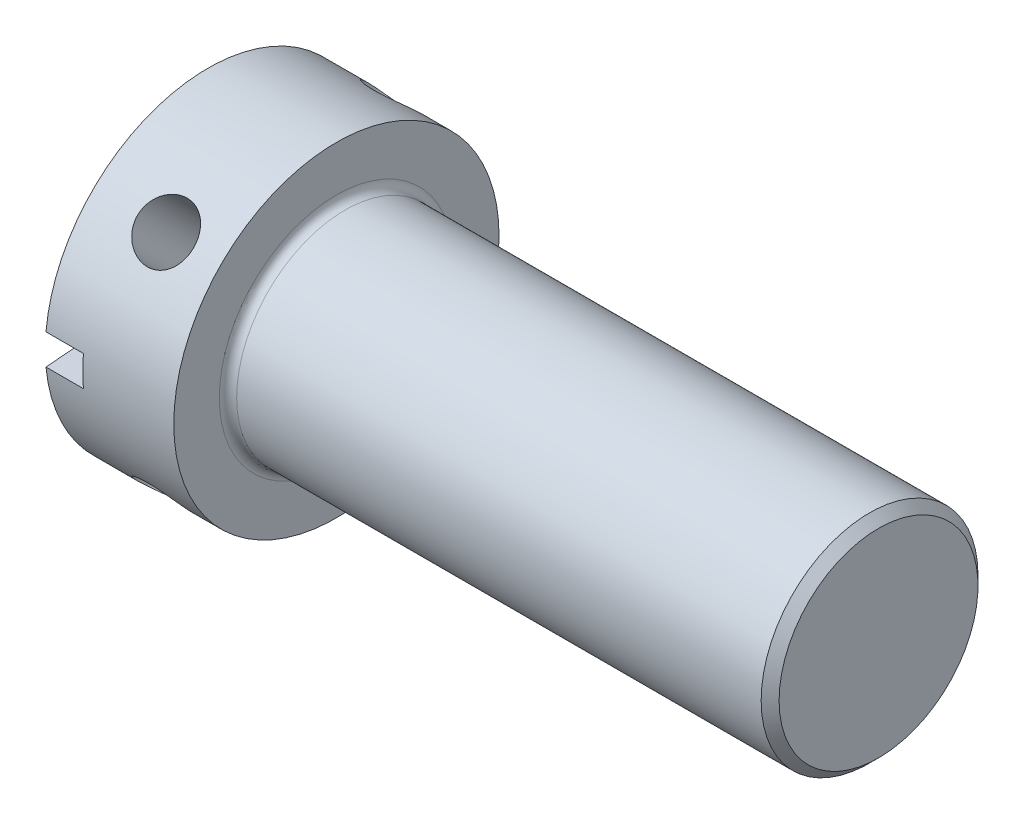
SolidWorks part; units mm, degrees
ref_plane "Plane1" through (0, 0, 0) normal (0, 0, 1) x (1, 0, 0)
ref_plane "Plane2" through (0, 0, 0) normal (0, 1, 0) x (1, 0, 0)
ref_plane "Plane3" through (0, 0, 0) normal (1, 0, 0) x (0, 0, -1)
sketch "BodySke" plane through (0, 0, 0) normal (0, 0, 1) x (1, 0, 0)
  line L1 (0.65, 15) -> (12.5, 15)
  line L2 (12.5, 15) -> (12.5, 10)
  line L3 (12.5, 10) -> (61.672, 10)
  line L4 (62.5, 9.172) -> (62.5, 0)
  line L5 (62.5, 0) -> (0, 0)
  line L6 (-31.75, 0) -> (127, 0) construction
  line L7 (0.65, 15) -> (0.65, -2.9344) construction
  line L8 (62.5, 9.172) -> (61.672, 10)
  line L10 (62.5, -9.172) -> (61.672, -10) construction
  line L11 (14, 4.525) -> (14, -1.825) construction
  line L12 (22.5, 4.525) -> (22.5, -1.825) construction
  line L13 (2.5, 4.525) -> (2.5, -1.825) construction
  arc A0 (0, 0) -> (0.65, 15) centre (173.4019, 0) cw
  dimension "Diameter" = 20
  dimension "Head_ht" = 12.5
  dimension "Length" = 50
  dimension "Body_ch_ang" = 45
  dimension "Head_dia" = 30
  dimension "Minor_dia" = 18.344
  dimension "Advance" = 1.5
  dimension "Thread_nom" = 40
  dimension "Thread_length" = 60
  dimension "Curve" = 0.65
revolve "Base-Revolve" add sketch "BodySke"
fillet "Fillet1" radius 0.8 1 edges at (12.5, 0, 10)
sketch "ThdSchSke" plane through (0, 0, 0) normal (0, 0, 1) x (1, 0, 0)
  line L0 (22.5, -9.172) -> (21.9202, -10)
  line L1 (22.5, -9.172) -> (23.0798, -10)
  line L2 (23.0798, -10) -> (23.0798, -12.5)
  line L3 (-3.175, 0) -> (5.1513, 0) construction
  line L5 (23.0798, -12.5) -> (21.9202, -12.5)
  line L6 (21.9202, -12.5) -> (21.9202, -10)
  dimension "Thread_minor" = 18.344
  dimension "Diameter" = 20
  dimension "Start" = 22.5
  dimension "SideAngle" = 55
  dimension "VeeAngle" = 70
  dimension "Overcut" = 25
revolve "ThreadSchematic" [suppressed] cut sketch "ThdSchSke" angle 360 about L3
pattern_linear "ThdSchPat" [suppressed]
sketch "Sketch3" plane through (0, 0, 0) normal (0, 0, 1) x (1, 0, 0)
  line L0 (-8.4745, 0) -> (15.3992, 0) construction
  line L1 (-31.75, 0) -> (127, 0) construction
  line L2 (0.0057, 1.405) -> (4.1057, 1.405)
  line L3 (0.0057, -1.405) -> (4.1057, -1.405)
  line L4 (4.1057, 1.405) -> (4.1057, -1.405)
  arc A0 (0.65, 15) -> (0.65, -15) centre (173.4019, 0) ccw construction
  point P12 (4.1057, 0)
  dimension "Slot_wid" = 2.81
  dimension "Slot_dep" = 4.1
extrude "Slot" cut sketch "Sketch3" against normal through all and the other way through all
ref_plane "Plane4" through (0, 0, 0) normal (0, 0.7071, 0.7071) x (1, 0, 0)
sketch "HoleSke" plane through (0, 0, 0) normal (0, 0.7071, 0.7071) x (1, 0, 0)
  line L0 (12.5, -15) -> (12.5, 15) construction
  circle A0 centre (7.35, 0) radius 2.59
  dimension "diameter" = 5.18
  dimension "position" = 5.15
extrude "Drill Hole" cut sketch "HoleSke" against normal through all and the other way through all
pattern_circular "Drill Holes" count 2 every 90 about axis through (0, 0, 0) along (1, 0, 0) of "Drill Hole"
equation "\"Thread_minor@ThreadCosmetic\"  =  \"Minor_dia@BodySke\""
equation "\"Thread_length@ThreadCosmetic\" = ((sgn( (\"Length@BodySke\" - \"Advance@BodySke\" * 3.0) - \"Thread_nom@BodySke\" )-1)*( (\"Length@BodySke\" - \"Advance@BodySke\" * 3.0) - \"Thread_nom@BodySke\" ))/-2+ \"Thread_no"
equation "\"Thread_minor@ThdSchSke\" = \"Minor_dia@BodySke\""
equation "\"Diameter@ThdSchSke\" = \"Diameter@BodySke\""
equation "\"Overcut@ThdSchSke\" = \"Diameter@BodySke\" * 1.25"
equation "\"Start@ThdSchSke\" = \"Head_ht@BodySke\" + \"Length@BodySke\" - \"Thread_length@ThreadCosmetic\"  '---Non-countersunk---"
equation "\"Num_threads@ThdSchPat\" = int( \"Thread_length@ThreadCosmetic\" / \"Advance@BodySke\" + 0.999 )  + 1"
equation "\"Advance@ThdSchPat\" = \"Thread_length@ThreadCosmetic\" /  (\"Num_threads@ThdSchPat\" - 1) 'relax it"
equation "\"Num_threads@ThdSchPat\" = \"Num_threads@ThdSchPat\" - sgn( \"Num_threads@ThdSchPat\" - 1) '---chamfered tips only---"
